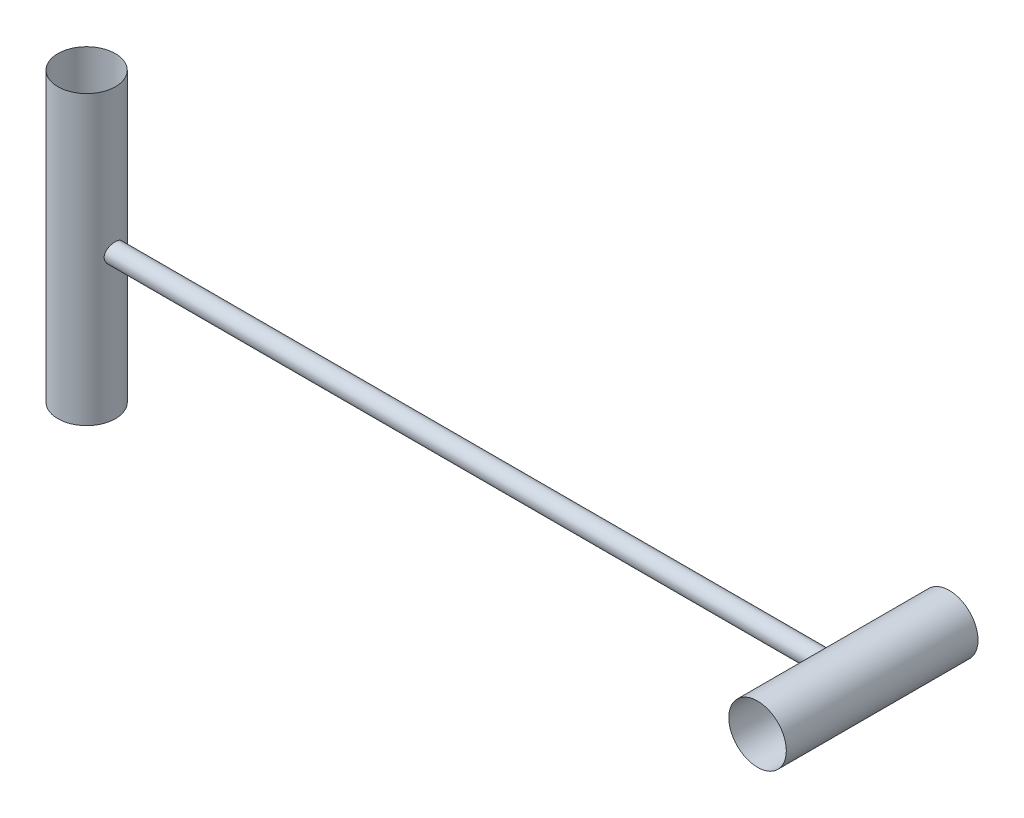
SolidWorks part; units mm, degrees
ref_plane "Plan de face" through (0, 0, 0) normal (0, 0, 1) x (1, 0, 0)
ref_plane "Plan de dessus" through (0, 0, 0) normal (0, 1, 0) x (1, 0, 0)
ref_plane "Plan de droite" through (0, 0, 0) normal (1, 0, 0) x (0, 0, -1)
sketch "Esquisse1" plane through (0, 0, 0) normal (0, 0, 1) x (1, 0, 0)
  circle A0 centre (0, 0) radius 6
  dimension "D1" = 12
surface "Surface-Extrusion1" sketch "Esquisse1" parameters "D1"=40
sketch "Esquisse2" plane through (0, 0, 0) normal (0, 1, 0) x (1, 0, 0)
  circle A0 centre (-160, 0) radius 6
  dimension "D1" = 12
  dimension "D2" = 160
surface "Surface-Extrusion2" sketch "Esquisse2" parameters "D1"=60
ref_plane "Plan1" through (-30, 0, 0) normal (1, 0, 0) x (0, 0, -1)
sketch "Esquisse3" plane through (-30, 0, 0) normal (1, 0, 0) x (0, 0, -1)
  circle A0 centre (0, 0) radius 2
  dimension "D1" = 4
surface "Surface-Extrusion3" sketch "Esquisse3"
